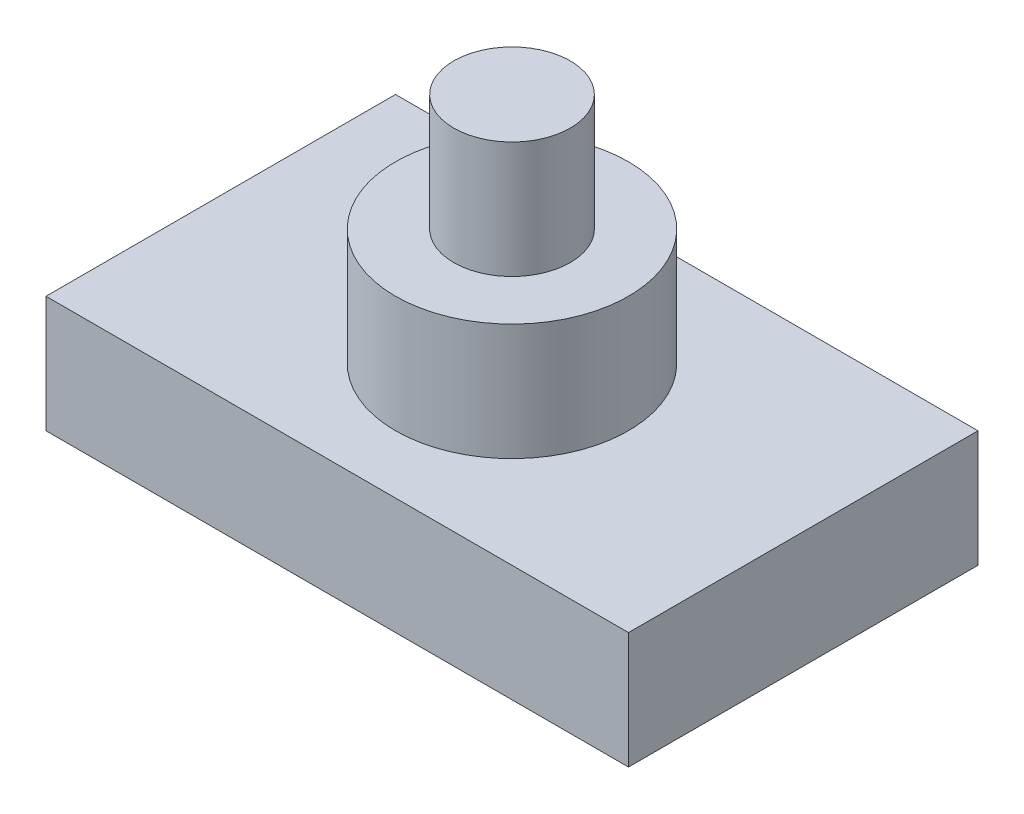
SolidWorks part; units mm, degrees
ref_plane "正面" through (0, 0, 0) normal (0, 0, 1) x (1, 0, 0)
ref_plane "平面" through (0, 0, 0) normal (0, 1, 0) x (1, 0, 0)
ref_plane "右側面" through (0, 0, 0) normal (1, 0, 0) x (0, 0, -1)
sketch "ｽｹｯﾁ1" plane through (0, 0, 0) normal (0, 1, 0) x (1, 0, 0)
  line L1 (-25, -15) -> (25, -15)
  line L2 (-25, -15) -> (-25, 15)
  line L3 (-25, 15) -> (25, 15)
  line L4 (25, -15) -> (25, 15)
  line L5 (-25, -15) -> (25, 15) construction
  line L6 (-25, 15) -> (25, -15) construction
  point P0 (0, 0)
  dimension "D1" = 50
  dimension "D2" = 30
extrude "ﾎﾞｽ - 押し出し1" add sketch "ｽｹｯﾁ1" along normal blind 10
sketch "ｽｹｯﾁ3" plane through (0, 10, 0) normal (0, 1, 0) x (1, 0, 0)
  circle A0 centre (0, 0) radius 10
  dimension "D1" = 20
extrude "ﾎﾞｽ - 押し出し3" add sketch "ｽｹｯﾁ3" along normal blind 10
sketch "ｽｹｯﾁ2" plane through (0, 20, 0) normal (0, 1, 0) x (1, 0, 0)
  circle A0 centre (0, 0) radius 5
  dimension "D1" = 10
extrude "ﾎﾞｽ - 押し出し2" add sketch "ｽｹｯﾁ2" along normal blind 10
